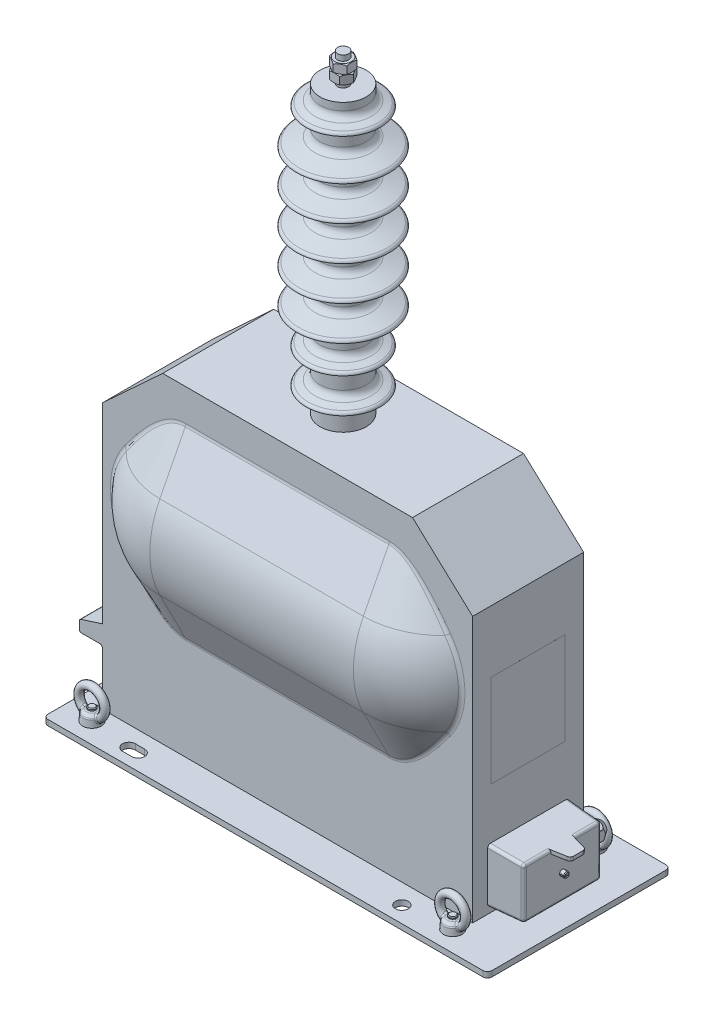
SolidWorks part; units mm, degrees
ref_plane "Front Plane" through (0, 0, 0) normal (0, 0, 1) x (1, 0, 0)
ref_plane "Top Plane" through (0, 0, 0) normal (0, 1, 0) x (1, 0, 0)
ref_plane "Right Plane" through (0, 0, 0) normal (1, 0, 0) x (0, 0, -1)
other "Join1"
other "29637-101_Kiöntött_FV_v6<1>@29637-100_FME-36ksz_FV_v6/29637-101_MűgyantaTestJoin_v6<1>@29637-101_Kiöntött_FV_v6"
other "29637-101_Kiöntött_FV_v6<1>@29637-100_FME-36ksz_FV_v6/29637-110_PrimerKivezetésKiöntött_v6<1>@29637-101_Kiöntött_FV_v6/29637-111_ÁtvezetőRúd_v6<1>@29637-110_PrimerKivezetésKiöntött_v6"
other "hatlapu-anya<1>@29637-100_FME-36ksz_FV_v6"
other "29637-101_Kiöntött_FV_v6<1>@29637-100_FME-36ksz_FV_v6/29637-110_PrimerKivezetésKiöntött_v6<1>@29637-101_Kiöntött_FV_v6/29637-110_MűgyantaTestMegvalósult_v6<1>@29637-110_PrimerKivezetésKiöntött_v6"
other "hatlapu-anya<2>@29637-100_FME-36ksz_FV_v6"
other "hlf-tm-csavar<1>@29637-100_FME-36ksz_FV_v6"
other "29700-120_SzekunderFedélAssy<1>@29637-100_FME-36ksz_FV_v6/29516-122_SzekunderFedél<1>@29700-120_SzekunderFedélAssy"
other "gyurus-anya<3>@29637-100_FME-36ksz_FV_v6"
other "bkny-sully-tm-csavar<3>@29637-100_FME-36ksz_FV_v6"
other "bkny-sully-tm-csavar<4>@29637-100_FME-36ksz_FV_v6"
other "gyurus-anya<4>@29637-100_FME-36ksz_FV_v6"
other "29637-108_Adattábla_v6<1>@29637-100_FME-36ksz_FV_v6"
other "gyurus-anya<1>@29637-100_FME-36ksz_FV_v6"
other "bkny-sully-tm-csavar<1>@29637-100_FME-36ksz_FV_v6"
other "bkny-sully-tm-csavar<2>@29637-100_FME-36ksz_FV_v6"
other "gyurus-anya<2>@29637-100_FME-36ksz_FV_v6"
other "29700-120_SzekunderFedélAssy<1>@29637-100_FME-36ksz_FV_v6/tomszelence<1>@29700-120_SzekunderFedélAssy"
other "29700-120_SzekunderFedélAssy<1>@29637-100_FME-36ksz_FV_v6/21105-115_PlombaCsavar<1>@29700-120_SzekunderFedélAssy"
other "bkny-sully-tm-csavar<5>@29637-100_FME-36ksz_FV_v6"
other "bkny-sully-tm-csavar<7>@29637-100_FME-36ksz_FV_v6"
other "29637-101_Kiöntött_FV_v6<1>@29637-100_FME-36ksz_FV_v6/29637-102_SzereltFeszváltó_v6<1>@29637-101_Kiöntött_FV_v6/29637-103_Bandázsolt_FV_v6<1>@29637-102_SzereltFeszváltó_v6/29637-104_Előszerelt_FV_v6<1"
other "bkny-sully-tm-csavar<9>@29637-100_FME-36ksz_FV_v6"
other "bkny-sully-tm-csavar<6>@29637-100_FME-36ksz_FV_v6"
other "bkny-sully-tm-csavar<8>@29637-100_FME-36ksz_FV_v6"
other "bkny-sully-tm-csavar<10>@29637-100_FME-36ksz_FV_v6"
other "bkny-sully-tm-csavar<12>@29637-100_FME-36ksz_FV_v6"
other "bkny-sully-tm-csavar<11>@29637-100_FME-36ksz_FV_v6"
other "29637-121_Alaplemez_v6<1>@29637-100_FME-36ksz_FV_v6"
